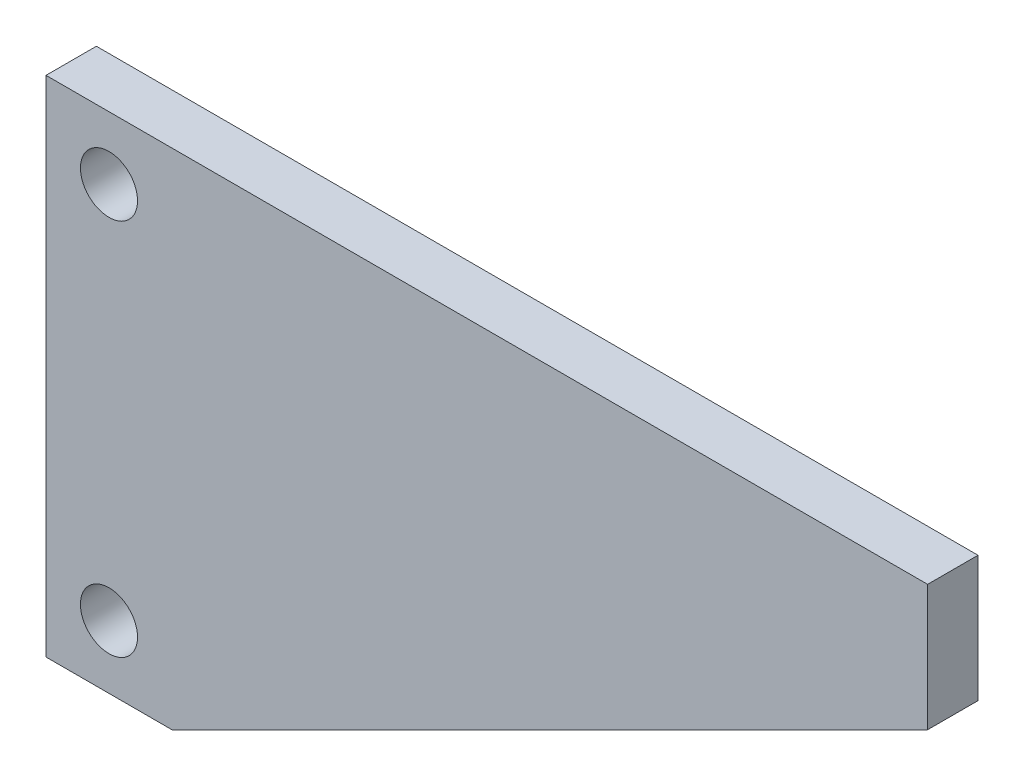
SolidWorks part; units mm, degrees
ref_plane "Front Plane" through (0, 0, 0) normal (0, 0, 1) x (1, 0, 0)
ref_plane "Top Plane" through (0, 0, 0) normal (0, 1, 0) x (1, 0, 0)
ref_plane "Right Plane" through (0, 0, 0) normal (1, 0, 0) x (0, 0, -1)
sketch "Sketch1" plane through (0, 0, 0) normal (0, 0, 1) x (1, 0, 0)
  line L0 (0, 100) -> (175, 100)
  line L1 (175, 100) -> (175, 75)
  line L2 (175, 75) -> (25, 0)
  line L3 (25, 0) -> (0, 0)
  line L4 (0, 0) -> (0, 100)
  dimension "D1" = 100
  dimension "D2" = 175
  dimension "D3" = 25
  dimension "D4" = 25
extrude "Boss-Extrude1" add sketch "Sketch1" along normal mid plane 10
sketch "Sketch2" plane through (0, 0, 5) normal (0, 0, 1) x (1, 0, 0)
  line L0 (50, 71) -> (50, 50.1591)
  line L1 (58.6833, 44.7925) -> (100.3652, 65.6334)
  line L2 (56, 77) -> (97.6819, 77)
  line L3 (25, 0) -> (175, 75) construction
  line L4 (175, 100) -> (0, 100) construction
  line L5 (0, 100) -> (0, 0) construction
  arc A0 (97.6819, 77) -> (100.3652, 65.6334) centre (97.6819, 71) cw
  arc A1 (50, 50.1591) -> (58.6833, 44.7925) centre (56, 50.1591) ccw
  arc A2 (56, 77) -> (50, 71) centre (56, 71) ccw
  dimension "D3" = 6
  dimension "D1" = 23
  dimension "D2" = 25
  dimension "D4" = 50
extrude "Cut-Extrude1" [suppressed] cut sketch "Sketch2" against normal through all
sketch "Sketch3" plane through (0, 0, 5) normal (0, 0, 1) x (1, 0, 0)
  line L0 (0, 100) -> (0, 0) construction
  line L1 (0, 0) -> (25, 0) construction
  circle A0 centre (12.5, 87.5) radius 5.6676
  circle A1 centre (12.5, 12.5) radius 5.6676
  dimension "D1" = 12.5
  dimension "D2" = 12.5
  dimension "D3" = 75
extrude "Cut-Extrude2" cut sketch "Sketch3" against normal through all
